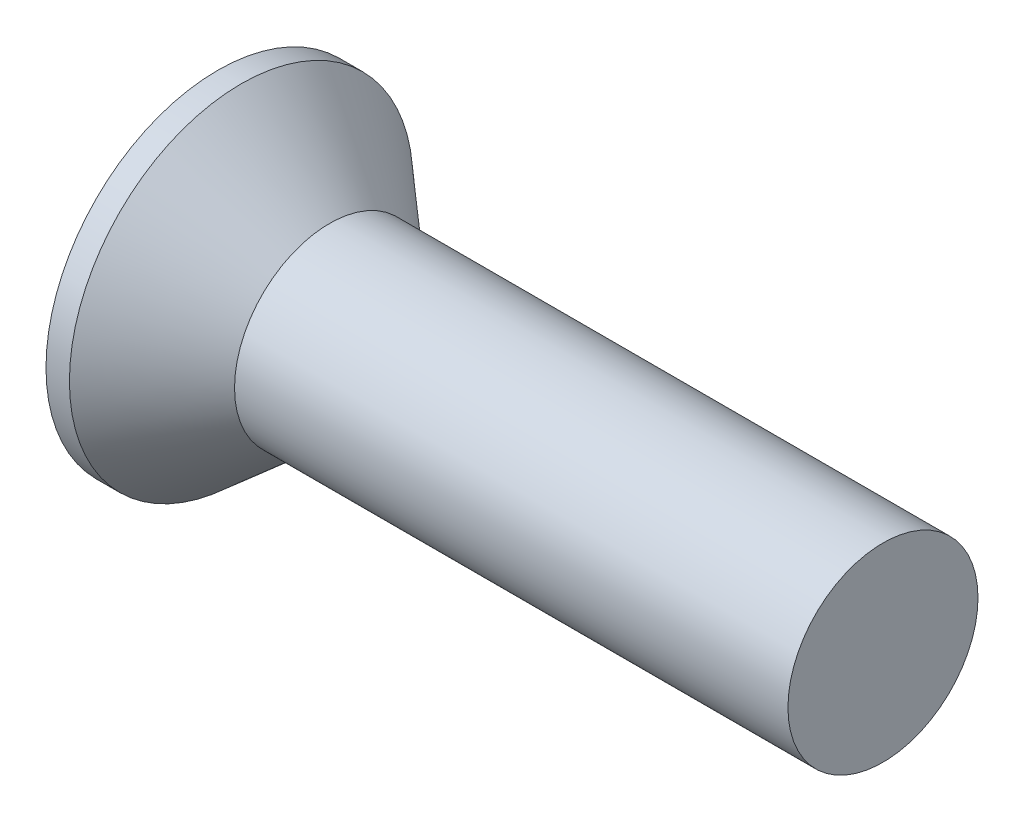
SolidWorks part; units mm, degrees
revolve "Base-Revolve" add sketch "BodySke" angle 360 about L5
sketch "BodySke" plane through (0, 0, 0) normal (0, 0, 1) x (1, 0, 0)
  line L0 (0, 0) -> (0, 5.7404)
  line L1 (0, 5.7404) -> (0.7826, 5.7404)
  line L2 (3.7338, 3.175) -> (22.225, 3.175)
  line L3 (22.225, 3.175) -> (22.225, 0)
  line L4 (22.225, 0) -> (0, 0)
  line L5 (-6.35, 0) -> (82.55, 0) construction
  line L6 (3.7338, -3.175) -> (22.225, -3.175) construction
  line L7 (0.7826, -5.7404) -> (3.7338, -3.175) construction
  line L8 (0.7826, 5.7404) -> (3.7338, 3.175)
  line L9 (0, -5.7404) -> (0.7826, -5.7404) construction
  line L10 (5.0038, 4.7625) -> (5.0038, -4.7625) construction
  line L11 (0, 6.35) -> (0, -3.175) construction
extrude "Slot" cut sketch "Sketch2" against normal blind 1.778
sketch "Sketch2" plane through (0, 0, 0) normal (-1, 0, 0) x (0, 0, 1)
  line L0 (-5.7404, -0.9525) -> (5.7404, -0.9525)
  line L1 (-5.7404, -0.9525) -> (-5.7404, 0.9525)
  line L2 (5.7404, 0.9525) -> (-5.7404, 0.9525)
  line L3 (5.7404, 0.9525) -> (5.7404, -0.9525)
ref_plane "Plane1" through (0, 0, 0) normal (0, 0, 1) x (1, 0, 0)
ref_plane "Plane2" through (0, 0, 0) normal (0, 1, 0) x (1, 0, 0)
ref_plane "Plane3" through (0, 0, 0) normal (1, 0, 0) x (0, 0, -1)
sketch "Sketch3" plane through (0, 0, 0) normal (-1, 0, 0) x (0, 0, 1)
  line L0 (-0.7747, 4.5085) -> (0.7747, 4.5085)
  line L1 (0.7747, 4.5085) -> (0.7747, -4.5085)
  line L2 (0.7747, -4.5085) -> (-0.7747, -4.5085)
  line L3 (-0.7747, -4.5085) -> (-0.7747, 4.5085)
ref_plane "Plane4" through (5.1816, 0, 0) normal (-1, 0, 0) x (0, 0, 1)
sketch "Sketch4" plane through (5.1816, 0, 0) normal (-1, 0, 0) x (0, 0, 1)
  line L0 (-0.3873, 0.3873) -> (0.3873, 0.3873)
  line L3 (0.3873, 0.3873) -> (0.3874, -0.3873)
  line L4 (0.3874, -0.3873) -> (-0.3873, -0.3873)
  line L5 (-0.3873, -0.3873) -> (-0.3873, 0.3873)
loft "Cross" cut profiles "Sketch3", "Sketch4"
pattern_circular "CirPattern1" count 2 every 90 about axis through (0, 0, 0) along (1, 0, 0) of "Cross"
sketch "ThdSchSke" plane through (0, 0, 0) normal (0, 0, 1) x (1, 0, 0)
  line L0 (5.0038, -2.4194) -> (4.4747, -3.175)
  line L1 (5.0038, -2.4194) -> (5.5329, -3.175)
  line L2 (5.5329, -3.175) -> (5.5329, -3.9687)
  line L3 (-3.175, 0) -> (5.1513, 0) construction
  line L5 (5.5329, -3.9687) -> (4.4747, -3.9688)
  line L6 (4.4747, -3.9688) -> (4.4747, -3.175)
  line L7 (0, 5.7404) -> (0, -5.7404) construction
revolve "ThreadSchematic" [suppressed] cut sketch "ThdSchSke" angle 360 about L3
pattern_linear "ThdSchPat" [suppressed]
equation "\"D1@Sketch3\" = \"Cross_dia@Sketch3\" / 2"
equation "\"D2@Sketch3\" = \"Cross_width@Sketch3\" / 2"
equation "\"D1@Sketch4\" = \"Cross_width@Sketch3\" *.5"
equation "\"D2@Sketch4\" = \"D1@Sketch4\""
equation "\"D4@Sketch4\" = \"D2@Sketch4\" / 2"
equation "\"D3@Sketch4\" = \"D1@Sketch4\" / 2"
equation "\"D1@Sketch2\" = \"Slot_width@Sketch2\" / 2"
equation "\"D2@Sketch2\" = \"Head_dia@BodySke\""
equation "\"D3@Sketch2\" = \"D2@Sketch2\" / 2"
equation "\"Thread_length@ThreadCosmetic\" = ((sgn( (\"Length@BodySke\" - \"Advance@BodySke\" - \"Head_ht@BodySke\" ) - \"Thread_nom@BodySke\" )-1)*( (\"Length@BodySke\" - \"Advance@BodySke\" - \"Head_ht@BodySke\" ) - \"Thread_"
equation "\"Thread_minor@ThdSchSke\" = \"Thread_minor@ThreadCosmetic\""
equation "\"Diameter@ThdSchSke\" = \"Diameter@BodySke\""
equation "\"Overcut@ThdSchSke\" = \"Diameter@BodySke\" * 1.25"
equation "\"Start@ThdSchSke\" = 0.000001 + \"Length@BodySke\" - \"Thread_length@ThreadCosmetic\"  '---Countersunk---"
equation "\"Num_threads@ThdSchPat\" = int( \"Thread_length@ThreadCosmetic\" / \"Advance@BodySke\" + 0.999 )  + 1"
equation "\"Advance@ThdSchPat\" = \"Thread_length@ThreadCosmetic\" /  (\"Num_threads@ThdSchPat\" - 1) 'relax it"
